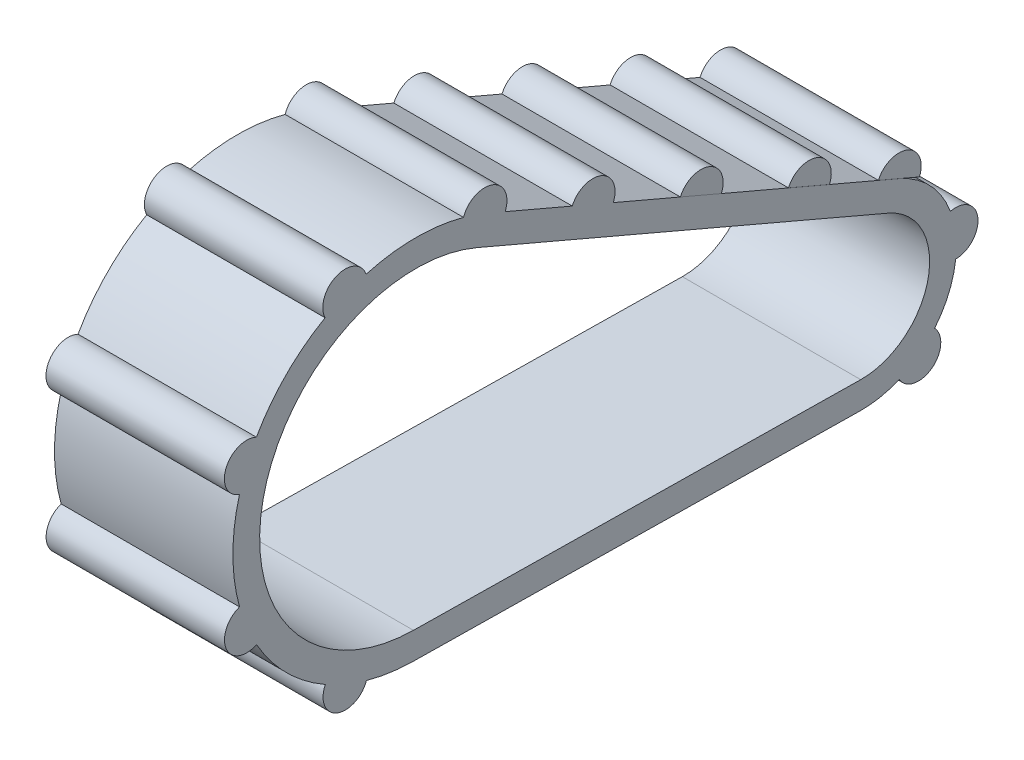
SolidWorks part; units mm, degrees
ref_plane "Front Plane" through (0, 0, 0) normal (0, 0, 1) x (1, 0, 0)
ref_plane "Top Plane" through (0, 0, 0) normal (0, 1, 0) x (1, 0, 0)
ref_plane "Right Plane" through (0, 0, 0) normal (1, 0, 0) x (0, 0, -1)
sketch "Sketch1" plane through (0, 0, 0) normal (1, 0, 0) x (0, 0, -1)
  circle A0 centre (0, 0) radius 7.1142
  dimension "D1" = 14.2285
sketch "Sketch2" plane through (0, 0, 0) normal (1, 0, 0) x (0, 0, -1)
  circle A0 centre (-50, 10.6191) radius 17
  dimension "D1" = 34
  dimension "D2" = 50
sketch "Sketch4" plane through (0, 0, 0) normal (1, 0, 0) x (0, 0, -1)
  line L0 (2.7959, 6.5418) -> (-43.3189, 26.2512)
  line L1 (-50.2489, -6.3791) -> (-0.1042, -7.1135)
  line L2 (-50.2563, -6.879) -> (-0.1115, -7.6134)
  line L3 (2.9925, 7.0016) -> (-43.1224, 26.7109)
  line L4 (-50.3002, -9.8787) -> (-0.1554, -10.6131)
  line L5 (4.1715, 9.7602) -> (-41.9433, 29.4696)
  arc A0 (-43.3189, 26.2512) -> (-50.2489, -6.3791) centre (-50, 10.6191) ccw
  arc A1 (-0.1042, -7.1135) -> (2.7959, 6.5418) centre (0, 0) ccw
  arc A2 (-43.1224, 26.7109) -> (-50.2563, -6.879) centre (-50, 10.6191) ccw
  arc A3 (-0.1115, -7.6134) -> (2.9925, 7.0016) centre (0, 0) ccw
  arc A4 (-0.1554, -10.6131) -> (4.1715, 9.7602) centre (0, 0) ccw
  arc A5 (-41.9433, 29.4696) -> (-50.3002, -9.8787) centre (-50, 10.6191) ccw
  dimension "D1" = 0.5
  dimension "D2" = 3
extrude "Boss-Extrude1" add sketch "Sketch4" along normal blind 20 contours L5 A5 L4 A4 A3 L2 A2 L3
sketch "Sketch5" plane through (0, 9.7602, -4.1715) normal (0, 0.9195, -0.393) x (1, 0, 0)
  line L1 (1.881, -34.8208) -> (15.3125, -34.8208)
  line L2 (1.881, -34.8208) -> (1.881, -41.5229)
  line L3 (1.881, -41.5229) -> (15.3125, -41.5229)
  line L4 (15.3125, -34.8208) -> (15.3125, -41.5229)
sketch "Sketch8" plane through (20, 0, 0) normal (1, 0, 0) x (0, 0, -1)
  line L0 (4.1715, 9.7602) -> (-41.9433, 29.4696) construction
  line L1 (-50.3002, -9.8787) -> (-0.1554, -10.6131) construction
  line L2 (4.1715, 9.7602) -> (-41.9433, 29.4696)
  line L3 (-50.3002, -9.8787) -> (-44.1542, -9.9687)
  line L4 (-50, 10.6191) -> (-41.9433, 29.4696) construction
  line L5 (-44.1542, -9.9687) -> (-0.1554, -10.6131)
  line L6 (16.2921, 4.581) -> (-29.8228, 24.2904)
  line L7 (28.4126, -0.5982) -> (-17.7022, 19.1112)
  line L8 (40.5332, -5.7774) -> (-5.5816, 13.932)
  line L9 (0, 0) -> (4.1715, 9.7602) construction
  arc A0 (-41.9433, 29.4696) -> (-50.3002, -9.8787) centre (-50, 10.6191) ccw construction
  arc A1 (-0.1554, -10.6131) -> (4.1715, 9.7602) centre (0, 0) ccw construction
  arc A2 (-41.9433, 29.4696) -> (-50.3002, -9.8787) centre (-50, 10.6191) ccw
  arc A3 (-0.1554, -10.6131) -> (4.1715, 9.7602) centre (0, 0) ccw
  arc A4 (-27.8533, 23.4475) -> (-32.451, 25.4125) centre (-30.153, 24.4281) ccw
  arc A5 (-15.7331, 18.2674) -> (-20.3308, 20.2324) centre (-18.0324, 19.2489) ccw
  arc A6 (-3.613, 13.0872) -> (-8.2106, 15.0522) centre (-5.9118, 14.0697) ccw
  arc A8 (-60.1362, -7.1997) -> (-55.5302, -9.1209) centre (-57.8919, -8.301) ccw
  arc A9 (-69.7552, 5.1436) -> (-67.8467, 0.5323) centre (-68.9418, 2.7796) ccw
  arc A10 (-67.8628, 20.6774) -> (-69.7639, 16.0631) centre (-68.9543, 18.4283) ccw
  arc A11 (-55.5616, 30.3502) -> (-60.1646, 28.4216) centre (-57.922, 29.5265) ccw
  arc A12 (-39.9735, 28.6276) -> (-44.6423, 30.4066) centre (-42.2735, 29.6073) ccw
  arc A13 (-41.1485, 31.8398) -> (-44.2978, 30.3101) centre (-41.9433, 29.4696) ccw
  arc A14 (-30.0546, 15.9747) -> (-32.0659, 20.5498) centre (-30.9905, 18.2929) ccw
  arc A15 (-32.087, 0.3416) -> (-30.2843, 5.0028) centre (-31.1146, 2.6447) ccw
  arc A16 (6.3386, 8.5138) -> (1.8726, 10.7427) centre (4.1715, 9.7602) ccw
  arc A17 (10.5424, -1.2325) -> (9.9495, 3.6972) centre (10.5383, 1.2675) ccw
  arc A18 (4.2038, -9.7463) -> (8.1766, -6.768) centre (6.3668, -8.4927) ccw
  arc A22 (-10.5424, 1.2325) -> (-10.2398, -3.7496) centre (-10.5383, -1.2675) ccw
  arc A23 (-4.2038, 9.7463) -> (-8.3671, 6.9931) centre (-6.3668, 8.4927) ccw
  arc A24 (-44.5574, -9.3027) -> (-44.1542, -9.9687) centre (-42.2433, -8.3568) ccw
  arc A25 (-6.3386, -8.5138) -> (-6.5534, -10.5194) centre (-4.1715, -9.7602) ccw
  dimension "D1" = 4
  dimension "D3" = 5
  dimension "D4" = 20.5
  dimension "D5" = 10.6142
  dimension "D2" = 9
extrude "Boss-Extrude4" add sketch "Sketch8" against normal blind 20
